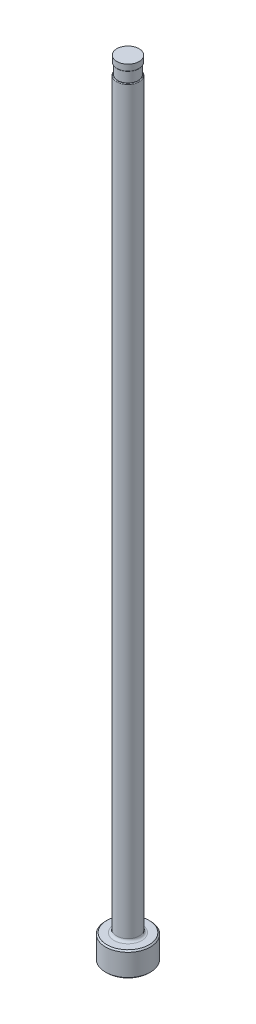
SolidWorks part; units mm, degrees
ref_plane "Front Plane" through (0, 0, 0) normal (0, 0, 1) x (1, 0, 0)
ref_plane "Top Plane" through (0, 0, 0) normal (0, 1, 0) x (1, 0, 0)
ref_plane "Right Plane" through (0, 0, 0) normal (1, 0, 0) x (0, 0, -1)
other "Configuration Table"
sketch "Sketch1" plane through (0, 0, 0) normal (0, 0, 1) x (1, 0, 0)
  line L0 (0, 259.9588) -> (0, -15.1925) construction
  line L1 (0, 0) -> (-4.3561, 0)
  line L2 (-4.3561, 0) -> (-4.3561, 4.7498)
  line L3 (-4.3561, 4.7498) -> (-2.1819, 4.7498)
  line L4 (-2.1819, 4.7498) -> (-2.1819, 152.4)
  line L5 (-2.1819, 152.4) -> (0, 152.4)
  line L6 (0, 152.4) -> (0, 0)
  dimension "L" = 152.4
  dimension "H" = 8.7122
  dimension "T" = 4.7498
  dimension "D" = 4.3637
revolve "Revolve1" add sketch "Sketch1" angle 360 about L0
chamfer "Chamfer1" distance 0.254 angle 45 2 edges at (0, 4.7498, 4.3561) (0, 0, 4.3561)
fillet "Fillet1" radius 0.508 1 edges at (0, 4.7498, 2.1819)
sketch "Sketch2" plane through (0, 0, 0) normal (0, 0, 1) x (1, 0, 0)
  line L0 (-2.1819, 152.4) -> (-2.1819, 5.2578) construction
  line L1 (-2.1819, 151.13) -> (-1.9787, 151.13)
  line L2 (-2.1819, 151.13) -> (-2.1819, 149.098)
  line L3 (-2.1819, 149.098) -> (-1.9787, 149.098)
  line L4 (-1.9787, 151.13) -> (-1.9787, 149.098)
  line L5 (2.1819, 152.4) -> (-2.1819, 152.4) construction
  line L6 (0, 153.4483) -> (0, 147.3282) construction
  dimension "D1" = 2.032
  dimension "N" = 1.27
  dimension "FD" = 0.2032
  dimension "D3" = 3.9573
revolve "Vent Relief" cut sketch "Sketch2" angle 360 about L6
sketch "Sketch3" plane through (0, 0, 0) normal (0, 0, 1) x (1, 0, 0)
  line L0 (-1.9787, 150.114) -> (-1.9787, 86.614)
  line L1 (-1.9787, 151.13) -> (-1.9787, 149.098) construction
  line L2 (-2.1819, 149.098) -> (-2.1819, 5.2578) construction
  line L3 (-2.1819, 85.4964) -> (-2.1819, 150.114)
  line L4 (-2.1819, 150.114) -> (-1.9787, 150.114)
  arc A0 (-1.9787, 86.614) -> (-2.1819, 85.4964) centre (-5.1537, 86.614) cw
  dimension "D1" = 3.175
  dimension "D2" = 63.5
extrude "D-Slot" cut sketch "Sketch3" against normal through all both and the other way through all
sketch "Sketch5" plane through (0, 0, 0) normal (0, 0, 1) x (1, 0, 0)
  line L0 (-2.1819, 151.13) -> (2.1819, 151.13) construction
  line L1 (-2.1819, 152.4) -> (-2.1628, 152.4)
  line L2 (-2.1819, 152.4) -> (-2.1819, 151.13)
  line L3 (-2.1819, 151.13) -> (-2.1628, 151.13)
  line L4 (-2.1628, 152.4) -> (-2.1628, 151.13)
  line L5 (0, 152.6877) -> (0, 150.5771) construction
  dimension "VP" = 0.019
revolve "Vent Diameter" cut sketch "Sketch5" angle 360 about L5
fillet "Fillet2" radius 0.127 2 edges at (2.1819, 149.098, 0) (0, 151.13, 2.1628)
sketch "Pocket Sketch" plane through (0, 0, 0) normal (0, 0, 1) x (1, 0, 0)
  line L0 (-4.753, 0) -> (-4.753, 4.7752)
  line L1 (-4.753, 4.7752) -> (-3.1423, 4.7752)
  line L2 (-2.3803, 5.5372) -> (-2.3803, 22.225)
  line L3 (-2.3803, 22.225) -> (0, 22.225)
  line L4 (0, 22.225) -> (0, 0)
  line L5 (0, 0) -> (-4.753, 0)
  line L6 (0, 12.6104) -> (0, -2.4989) construction
  line L7 (-4.3561, 4.4958) -> (-4.3561, 0.254) construction
  line L8 (4.1021, 4.7498) -> (-4.1021, 4.7498) construction
  line L9 (-2.1819, 85.4964) -> (-2.1819, 5.2578) construction
  line L10 (-3.1423, 4.7752) -> (-2.3803, 5.5372)
  point P3 (-2.3803, 4.7752)
  dimension "D1" = 9.5059
  dimension "D2" = 0.3969
  dimension "D3" = 0.0254
  dimension "D4" = 0.1984
  dimension "D5" = 4.7606
  dimension "D6" = 22.225
